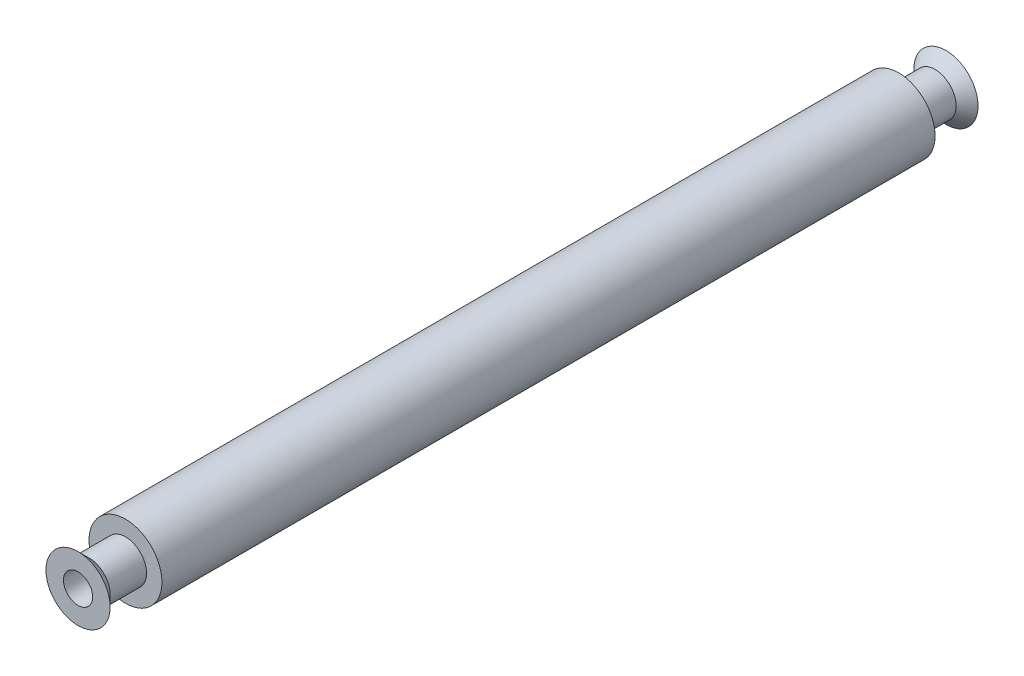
SolidWorks part; units mm, degrees
ref_plane "Plan1" through (0, 0, 0) normal (0, 0, 1) x (1, 0, 0)
ref_plane "Plan2" through (0, 0, 0) normal (0, 1, 0) x (1, 0, 0)
ref_plane "Plan3" through (0, 0, 0) normal (1, 0, 0) x (0, 0, -1)
sketch "Esquisse1" plane through (0, 0, 0) normal (0, 0, 1) x (1, 0, 0)
  circle A0 centre (0, 0) radius 5
  dimension "D1" = 10
extrude "Base-Extrusion" add sketch "Esquisse1" along normal blind 106
sketch "Esquisse4" plane through (0, 0, 106) normal (0, 0, 1) x (1, 0, 0)
  circle A0 centre (0, 0) radius 3.15
  dimension "D1" = 6.3
extrude "Boss.-Extru.1" [suppressed] add sketch "Esquisse4" along normal blind 7
other "Perçage1" parameters "D1"=4
sketch "Esquisse5" plane through (0, 0, 113) normal (0, 0, 1) x (1, 0, 0)
  circle A0 centre (0, 0) radius 2
  dimension "D1" = 4
ref_plane "Plan4" [suppressed] through (0, 0, 53) normal (0, 0, 1) x (1, 0, 0)
mirror "Symétrie1" [suppressed] about plane through (0, 0, 53) normal (0, 0, 1)
sketch "Esquisse6" plane through (0, 0, 0) normal (1, 0, 0) x (0, 0, -1)
  line L0 (0, 0) -> (-109.0584, 0) construction
  line L1 (-106, 0) -> (-106, 2.8958)
  line L2 (-106, 2.8958) -> (-111, 2.8958)
  line L3 (-111, 2.8958) -> (-112.5, 4.3958)
  line L4 (-112.5, 4.3958) -> (-112.5, 0)
  line L5 (-112.5, 0) -> (-106, 0)
  line L6 (-106, 5) -> (-106, -5) construction
  dimension "D1" = 6.5
  dimension "D2" = 5
  dimension "D3" = 45
revolve "Boss.-Révol.1" add sketch "Esquisse6" angle 360 about L0
other "Perçage2" parameters "D1"=4
sketch "Esquisse7" plane through (0, 0, 112.5) normal (0, 0, 1) x (1, 0, 0)
  circle A0 centre (0, 0) radius 2
  dimension "D1" = 4
mirror "Symétrie2" about plane through (0, 0, 53) normal (0, 0, 1) of "Perçage2", "Boss.-Révol.1"
